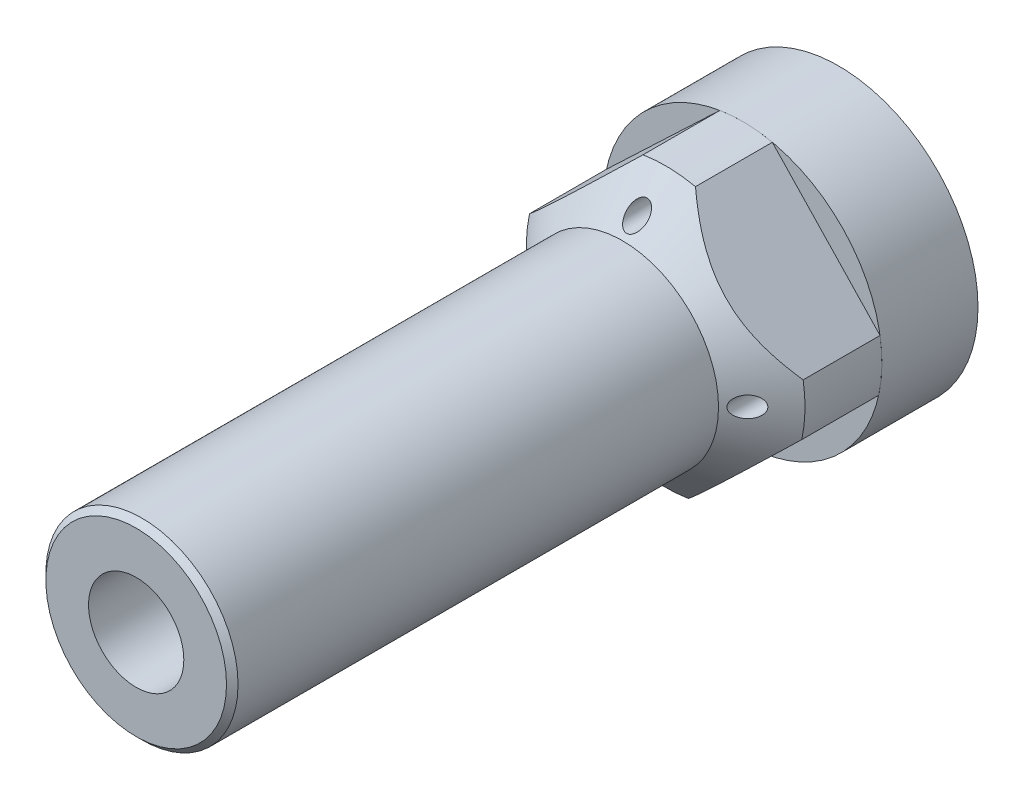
SolidWorks part; units mm, degrees
ref_plane "Front" through (0, 0, 0) normal (0, 0, 1) x (1, 0, 0)
ref_plane "Top" through (0, 0, 0) normal (0, 1, 0) x (1, 0, 0)
ref_plane "Right" through (0, 0, 0) normal (1, 0, 0) x (0, 0, -1)
sketch "Sketch1" plane through (0, 0, 0) normal (1, 0, 0) x (0, 0, -1)
  line L0 (0, 0) -> (25.5301, 0) construction
  line L1 (0, 11.938) -> (0, 6.2967)
  line L2 (0, 6.2967) -> (12.7, 6.2967)
  line L3 (12.7, 6.2967) -> (12.7787, 6.3754)
  line L5 (92.837, 0) -> (92.837, 18.415)
  line L6 (92.837, 18.415) -> (80.137, 18.415)
  line L7 (80.137, 18.415) -> (80.137, 6.35)
  line L9 (0.762, 12.7) -> (0, 11.938)
  line L11 (65.2146, 16.5036) -> (92.837, 16.5036) construction
  line L12 (65.2146, 16.5036) -> (65.2146, 12.7063) construction
  line L13 (65.2146, 12.7063) -> (92.837, 12.7064) construction
  line L14 (92.837, 16.5036) -> (92.837, 12.7064) construction
  line L15 (92.837, 18.5674) -> (96.647, 18.5674) construction
  line L16 (92.837, 18.5674) -> (92.837, 10.6426) construction
  line L17 (92.837, 10.6426) -> (96.647, 10.6426) construction
  line L18 (96.647, 18.5674) -> (96.647, 10.6426) construction
  line L19 (80.137, 6.35) -> (63.5, 6.35)
  line L20 (63.5, 6.35) -> (63.5, 0)
  line L21 (63.5, 0) -> (92.837, 0)
  line L22 (0.762, 12.7) -> (64.262, 12.7)
  line L23 (73.787, 0) -> (92.837, 0) construction
  line L24 (73.787, 0) -> (73.787, 5.5562) construction
  line L25 (73.787, 5.5562) -> (92.837, 5.5562) construction
  line L26 (92.837, 0) -> (92.837, 5.5562) construction
  line L27 (92.837, 0) -> (118.237, 0) construction
  line L28 (92.837, 0) -> (92.837, 11.43) construction
  line L29 (92.837, 11.43) -> (118.237, 11.43) construction
  line L30 (118.237, 0) -> (118.237, 11.43) construction
  line L31 (64.262, 12.7) -> (69.977, 18.415)
  line L32 (69.977, 18.415) -> (80.137, 18.415)
  line L33 (80.137, 18.415) -> (80.137, 6.3754)
  line L34 (80.137, 6.3754) -> (12.7787, 6.3754)
  line L35 (66.675, 6.35) -> (66.675, 4.445)
  line L36 (66.675, 4.445) -> (70.231, 4.445)
  line L37 (70.231, 4.445) -> (70.231, 6.35)
  line L38 (73.406, 6.35) -> (73.406, 4.445)
  line L39 (73.406, 4.445) -> (76.962, 4.445)
  line L40 (76.962, 4.445) -> (76.962, 6.35)
  line L41 (96.647, 14.605) -> (80.137, 14.605) construction
  circle A0 centre (67.945, 5.715) radius 1.27 construction
  circle A1 centre (74.676, 5.715) radius 1.27 construction
  point P2 (12.7787, 15.24)
  point P22 (92.837, 14.605)
  point P23 (92.837, 14.605)
  point P43 (69.46, 17.78)
  dimension "D15" = 8.89
  dimension "D16" = 2.54
  dimension "D1" = 12.5933
  dimension "D2" = 22.86
  dimension "D3" = 19.05
  dimension "D4" = 11.1125
  dimension "D5" = 12.7
  dimension "D6" = 45
  dimension "D7" = 45
  dimension "D8" = 23.876
  dimension "D9" = 12.7
  dimension "D10" = 3.7973
  dimension "D11" = 3.81
  dimension "D12" = 7.9248
  dimension "D13" = 1.9113
  dimension "D14" = 10.287
  dimension "D17" = 36.83
  dimension "D18" = 12.7
  dimension "D19" = 1.1112
  dimension "D20" = 3.556
  dimension "D21" = 3.175
  dimension "D22" = 3.175
  dimension "D23" = 3.175
  dimension "D24" = 12.7508
  dimension "D25" = 0
  dimension "D26" = 50.8
  dimension "D27" = 45
  dimension "D28" = 25.4
  dimension "D29" = 10.16
  dimension "D30" = 25.4
  dimension "D31" = 29.21
sketch "Sketch2" plane through (0, 0, 0) normal (1, 0, 0) x (0, 0, -1)
  line L0 (69.977, 18.415) -> (80.137, 18.415) construction
  line L1 (80.137, 18.415) -> (80.137, 6.3754) construction
  line L2 (80.137, 6.3754) -> (12.7787, 6.3754) construction
  line L3 (12.7, 6.2967) -> (12.7787, 6.3754) construction
  line L4 (0, 6.2967) -> (12.7, 6.2967) construction
  line L5 (0, 11.938) -> (0, 6.2967) construction
  line L6 (0.762, 12.7) -> (0, 11.938) construction
  line L7 (0.762, 12.7) -> (64.262, 12.7) construction
  line L8 (64.262, 12.7) -> (69.977, 18.415) construction
  line L9 (69.977, 18.415) -> (80.137, 18.415)
  line L10 (80.137, 18.415) -> (80.137, 6.3754)
  line L11 (80.137, 6.3754) -> (12.7787, 6.3754)
  line L12 (12.7, 6.2967) -> (12.7787, 6.3754)
  line L13 (0, 6.2967) -> (12.7, 6.2967)
  line L14 (0, 11.938) -> (0, 6.2967)
  line L15 (0.762, 12.7) -> (0, 11.938)
  line L16 (0.762, 12.7) -> (64.262, 12.7)
  line L17 (64.262, 12.7) -> (69.977, 18.415)
revolve "Revolve1" add sketch "Sketch2" angle 360 about L0
sketch "Sketch3" plane through (0, 0, 0) normal (1, 0, 0) x (0, 0, -1)
  line L0 (63.5, 6.35) -> (63.5, 0) construction
  line L1 (63.5, 0) -> (92.837, 0) construction
  line L2 (92.837, 0) -> (92.837, 18.415) construction
  line L3 (92.837, 18.415) -> (80.137, 18.415) construction
  line L4 (80.137, 18.415) -> (80.137, 6.35) construction
  line L5 (80.137, 6.35) -> (63.5, 6.35) construction
  line L6 (63.5, 6.35) -> (63.5, 0)
  line L7 (63.5, 0) -> (92.837, 0)
  line L8 (92.837, 0) -> (92.837, 18.415)
  line L9 (92.837, 18.415) -> (80.137, 18.415)
  line L10 (80.137, 18.415) -> (80.137, 6.35)
  line L11 (80.137, 6.35) -> (63.5, 6.35)
revolve "Revolve2" add sketch "Sketch3" angle 360 about L0
sketch "Sketch4" plane through (0, 0, 0) normal (1, 0, 0) x (0, 0, -1)
  line L0 (73.406, 4.445) -> (76.962, 4.445) construction
  line L1 (73.406, 6.35) -> (73.406, 4.445) construction
  line L2 (76.962, 4.445) -> (76.962, 6.35) construction
  line L3 (66.675, 4.445) -> (70.231, 4.445) construction
  line L4 (66.675, 6.35) -> (66.675, 4.445) construction
  line L5 (70.231, 4.445) -> (70.231, 6.35) construction
  line L6 (73.406, 4.445) -> (76.962, 4.445)
  line L7 (73.406, 6.35) -> (73.406, 4.445)
  line L8 (76.962, 4.445) -> (76.962, 6.35)
  line L9 (66.675, 4.445) -> (70.231, 4.445)
  line L10 (66.675, 6.35) -> (66.675, 4.445)
  line L11 (70.231, 4.445) -> (70.231, 6.35)
  line L12 (66.675, 6.35) -> (70.231, 6.35)
  line L14 (73.406, 6.35) -> (76.962, 6.35)
revolve "Cut-Revolve1" cut sketch "Sketch4" angle 360 about L0
sketch "Sketch5" plane through (0, 0, -92.837) normal (0, 0, -1) x (-1, 0, 0)
  point P0 (0, 14.605)
  point P3 (0, 0)
hole_wizard "#6 Clearance Hole1" positions "Sketch5" profile "Sketch6" hole size "#6" standard "ANSI Inch"
sketch "Sketch6" plane through (0, 14.605, -92.837) normal (1, 0, 0) x (0, 1, 0)
  line L0 (0, 0) -> (0, 16.6602)
  line L1 (0, 16.6602) -> (1.8986, 15.5194)
  line L2 (1.8986, 15.5194) -> (1.8986, 0)
  line L5 (1.8986, 0) -> (0, 0)
  line L10 (0, 16.6602) -> (-1.8987, 15.5194) construction
  line L11 (0, -6.35) -> (0, 107.95) construction
  dimension "Hole Dia." = 3.7973
  dimension "Hole Depth" = 15.5194
  dimension "Drill Angle" = 118
pattern_circular "CirPattern1" count 4 over 360 about axis through (0, 0, 0) along (0, 0, 1) of "#6 Clearance Hole1"
sketch "Sketch7" plane through (0, 0, -80.137) normal (0, 0, -1) x (-1, 0, 0)
  point P0 (0, 14.605)
  point P2 (0, 0)
hole_wizard "#6-32 Tapped Hole1" positions "Sketch7" profile "Sketch8" tap size "#6-32" standard "ANSI Inch"
sketch "Sketch8" plane through (0, 14.605, -80.137) normal (1, 0, 0) x (0, 1, 0)
  line L0 (0, 0) -> (0, 16.3321)
  line L1 (0, 16.3321) -> (1.3525, 15.5194)
  line L2 (1.3525, 15.5194) -> (1.3525, 0)
  line L5 (1.3525, 0) -> (0, 0)
  line L10 (0, 16.3321) -> (-1.3526, 15.5194) construction
  line L11 (0, -6.35) -> (0, 107.95) construction
  dimension "Tap Drill Dia." = 2.7051
  dimension "Tap Drill Depth" = 15.5194
  dimension "Drill Angle" = 118
pattern_circular "CirPattern2" count 4 over 360 about axis through (0, 0, 0) along (0, 0, 1) of "#6-32 Tapped Hole1"
sketch "Sketch9" plane through (0, 0, -80.137) normal (0, 0, -1) x (-1, 0, 0)
  line L0 (-18.1699, 2.9942) -> (-3.9373, 17.9892)
  line L1 (0, 0) -> (-11.0536, 10.4917) construction
  circle A0 centre (0, 0) radius 18.415 construction
  dimension "D1" = 15.24
extrude "Cut-Extrude1" cut sketch "Sketch9" against normal blind 19.05 and the other way through all
pattern_circular "CirPattern3" count 4 over 360 about axis through (0, 0, 0) along (0, 0, -1) of "Cut-Extrude1"
sketch "Sketch10" plane through (0, 0, -92.837) normal (0, 0, -1) x (-1, 0, 0)
  point P0 (0, 0)
hole_wizard "7/16-20 Tapped Hole1" positions "Sketch10" profile "Sketch11" tap size "7/16-20" standard "ANSI Inch"
sketch "Sketch11" plane through (0, 0, -92.837) normal (1, 0, 0) x (0, 1, 0)
  line L0 (0, 0) -> (0, 92.837)
  line L1 (0, 92.837) -> (4.9606, 92.837)
  line L2 (4.9606, 92.837) -> (4.9606, 0)
  line L5 (4.9606, 0) -> (0, 0)
  line L11 (0, -6.35) -> (0, 107.95) construction
  dimension "Thru Tap Drill Dia." = 9.9212
  dimension "Thru Tap Drill Depth" = 92.837
